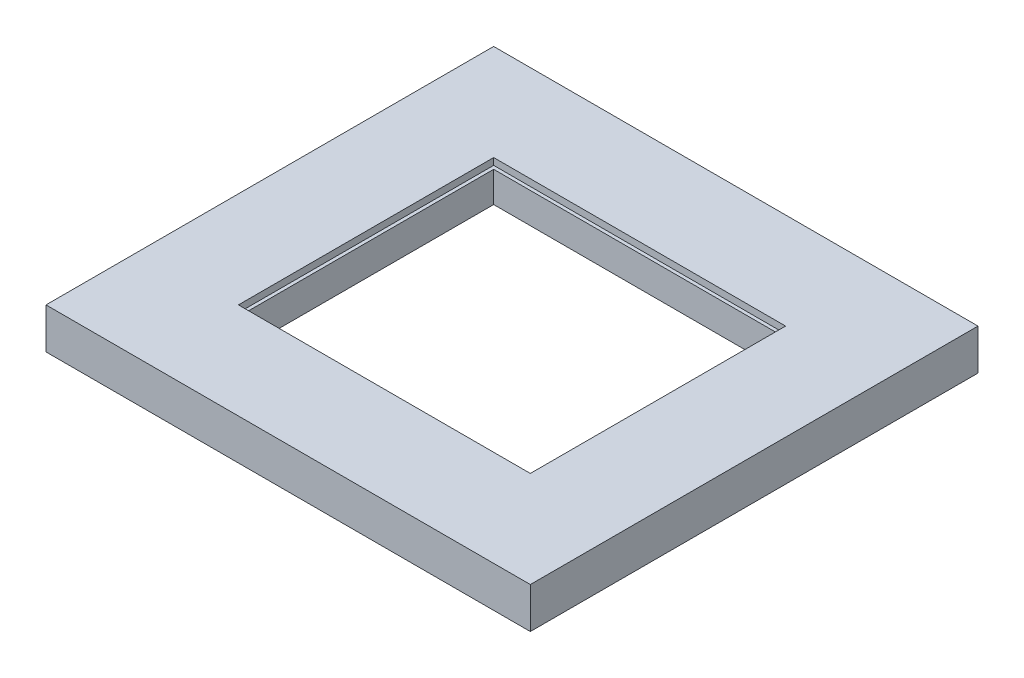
SolidWorks part; units mm, degrees
ref_plane "Front Plane" through (0, 0, 0) normal (0, 0, 1) x (1, 0, 0)
ref_plane "Top Plane" through (0, 0, 0) normal (0, 1, 0) x (1, 0, 0)
ref_plane "Right Plane" through (0, 0, 0) normal (1, 0, 0) x (0, 0, -1)
sketch "Sketch1" plane through (0, 0, 0) normal (0, 1, 0) x (1, 0, 0)
  line L1 (-68.265, 59.69) -> (68.265, 59.69)
  line L2 (-68.265, 59.69) -> (-68.265, -59.69)
  line L3 (-68.265, -59.69) -> (68.265, -59.69)
  line L4 (68.265, 59.69) -> (68.265, -59.69)
  line L5 (-68.265, 59.69) -> (68.265, -59.69) construction
  line L6 (-68.265, -59.69) -> (68.265, 59.69) construction
  line L7 (-113.265, 104.69) -> (113.265, 104.69)
  line L8 (-113.265, 104.69) -> (-113.265, -104.69)
  line L9 (-113.265, -104.69) -> (113.265, -104.69)
  line L10 (113.265, 104.69) -> (113.265, -104.69)
  line L11 (-113.265, 104.69) -> (113.265, -104.69) construction
  line L12 (-113.265, -104.69) -> (113.265, 104.69) construction
  point P0 (0, 0)
  point P6 (0, 0)
  dimension "D1" = 136.53
  dimension "D2" = 119.38
  dimension "D3" = 45
  dimension "D4" = 45
extrude "Boss-Extrude1" add sketch "Sketch1" along normal mid plane 14.29
sketch "Sketch2" plane through (0, 7.145, 0) normal (0, 1, 0) x (1, 0, 0)
  line L4 (93.665, -85.09) -> (-93.665, -85.09)
  line L5 (93.665, -85.09) -> (93.665, 85.09)
  line L6 (93.665, 85.09) -> (-93.665, 85.09)
  line L7 (-93.665, -85.09) -> (-93.665, 85.09)
  line L8 (113.265, -104.69) -> (113.265, 104.69) construction
  line L9 (-113.265, -104.69) -> (113.265, -104.69) construction
  line L10 (113.265, 104.69) -> (-113.265, 104.69) construction
  line L11 (-113.265, 104.69) -> (-113.265, -104.69) construction
  line L12 (113.265, -104.69) -> (113.265, 104.69)
  line L13 (-113.265, -104.69) -> (113.265, -104.69)
  line L14 (113.265, 104.69) -> (-113.265, 104.69)
  line L15 (-113.265, 104.69) -> (-113.265, -104.69)
  dimension "D1" = 19.6
  dimension "D2" = 19.6
  dimension "D3" = 19.6
  dimension "D4" = 19.6
extrude "Boss-Extrude2" add sketch "Sketch2" along normal blind 1.59
sketch "Sketch3" plane through (0, 8.735, 0) normal (0, 1, 0) x (1, 0, 0)
  line L4 (-113.265, -104.69) -> (113.265, -104.69)
  line L5 (113.265, -104.69) -> (113.265, 104.69)
  line L6 (113.265, 104.69) -> (-113.265, 104.69)
  line L7 (-113.265, 104.69) -> (-113.265, -104.69)
  line L8 (-113.265, -104.69) -> (113.265, -104.69)
  line L9 (113.265, -104.69) -> (113.265, 104.69)
  line L10 (113.265, 104.69) -> (-113.265, 104.69)
  line L11 (-113.265, 104.69) -> (-113.265, -104.69)
  line L12 (-68.265, -59.69) -> (68.265, -59.69)
  line L13 (68.265, -59.69) -> (68.265, 59.69)
  line L14 (68.265, 59.69) -> (-68.265, 59.69)
  line L15 (-68.265, 59.69) -> (-68.265, -59.69)
  dimension "D2" = 45
  dimension "D3" = 45
  dimension "D4" = 45
  dimension "D5" = 45
  dimension "D1" = 0
extrude "Boss-Extrude3" add sketch "Sketch3" along normal blind 3.17
